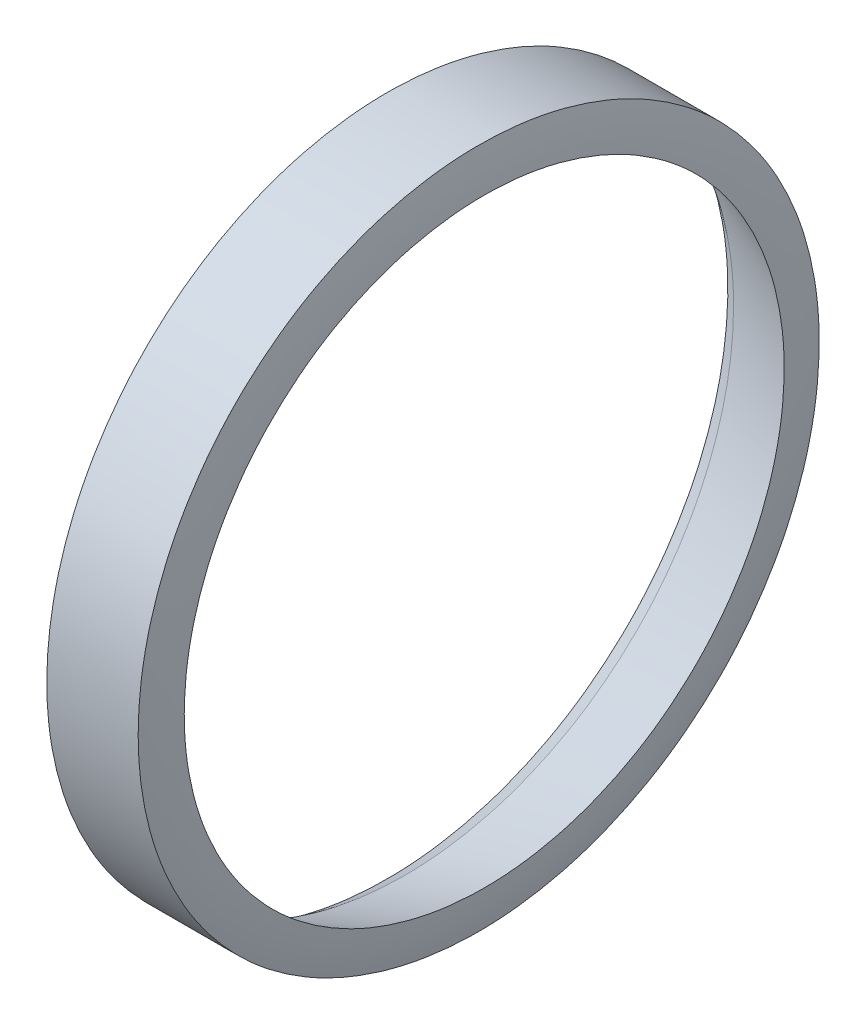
SolidWorks part; units mm, degrees
other "Detailelement1"
ref_plane "Ebene vorne" through (0, 0, 0) normal (0, 0, 1) x (1, 0, 0)
ref_plane "Ebene oben" through (0, 0, 0) normal (0, 1, 0) x (1, 0, 0)
ref_plane "Ebene rechts" through (0, 0, 0) normal (1, 0, 0) x (0, 0, -1)
other "Schweißnaht1"
